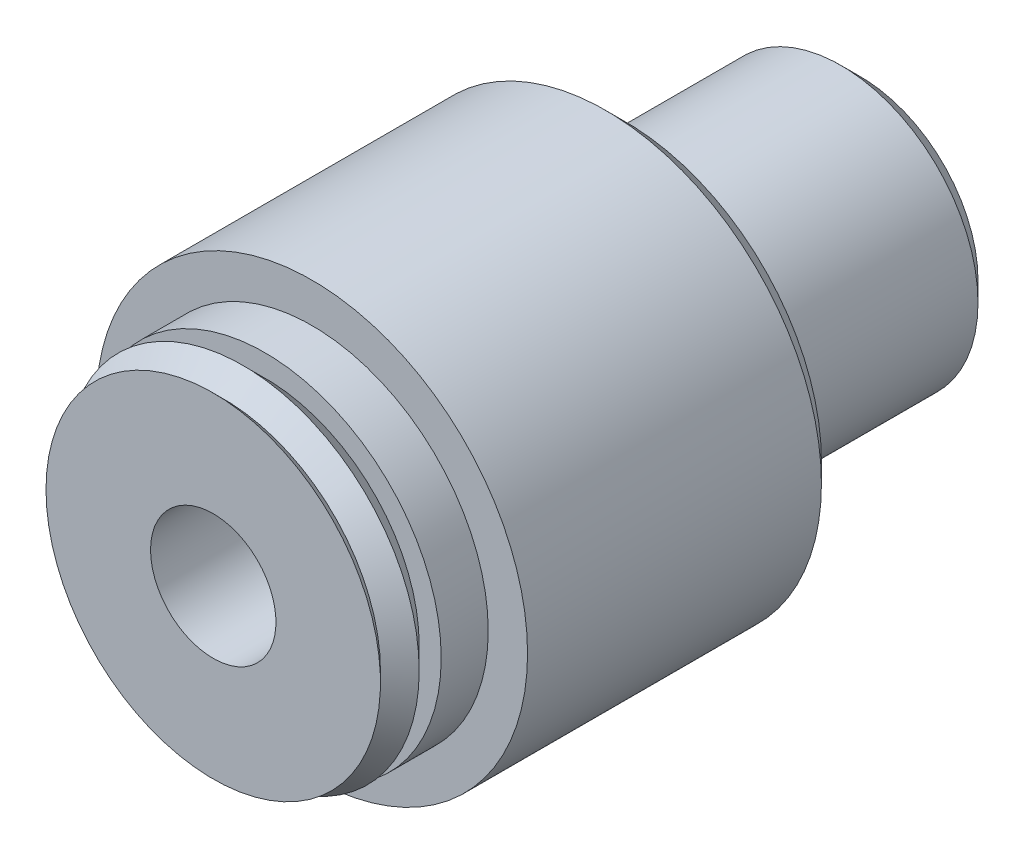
SolidWorks part; units mm, degrees
ref_plane "Front" through (0, 0, 0) normal (0, 0, 1) x (1, 0, 0)
ref_plane "Top" through (0, 0, 0) normal (0, 1, 0) x (1, 0, 0)
ref_plane "Right" through (0, 0, 0) normal (1, 0, 0) x (0, 0, -1)
ref_plane "Body Plane" through (0, 0, -3.9982) normal (0, 0, 1) x (1, 0, 0)
sketch "Sketch1" plane through (0, 0, 0) normal (1, 0, 0) x (0, 0, -1)
  line L0 (71.2941, 0) -> (-67.6458, 0) construction
  line L1 (0, 0) -> (0, 6.7754)
  line L2 (0, 6.7754) -> (0.4166, 6.3589)
  line L3 (0.4166, 6.3589) -> (1.2014, 7.1437)
  line L4 (1.2014, 7.1437) -> (2.0932, 6.252)
  line L5 (2.0932, 6.252) -> (2.0932, 7.1437)
  line L6 (2.0932, 7.1437) -> (3.9982, 7.1437)
  line L7 (3.9982, 7.1437) -> (3.9982, 0)
  line L8 (3.9982, 0) -> (0, 0)
  dimension "D1" = 45
  dimension "D2" = 7.1437
  dimension "外径" = 7.1437
  dimension "D4" = 0.8918
  dimension "D5" = 1.2014
  dimension "D6" = 6.7754
  dimension "Front Length" = 1.905
revolve "Base" add sketch "Sketch1" angle 360 about L0
sketch "Sketch4" plane through (0, 0, -3.9982) normal (0, 0, 1) x (1, 0, 0)
  circle A0 centre (0, 0) radius 8.7376
  dimension "D1" = 17.4752
extrude "Double Acting Stud Body" add sketch "Sketch4" against normal blind 12.7
sketch "Sketch5" plane through (0, 0, -16.6982) normal (0, 0, -1) x (-1, 0, 0)
  circle A0 centre (0, 0) radius 5.5562
  dimension "D1" = 11.1125
extrude "Double Acting Stud Body 2" add sketch "Sketch5" along normal blind 9.525
chamfer "Double Acting Stud Chamfer" distance 0.7937 angle 45 2 edges at (8.7376, 0, -16.6982) (-5.5562, 0, -26.2232)
sketch "Sketch8" plane through (0, 0, 0) normal (1, 0, 0) x (0, 0, -1)
  line L0 (15.9045, 0) -> (3.9982, 0) construction
  line L1 (3.9982, 8.7376) -> (3.9982, -8.7376) construction
  circle A0 centre (7.1732, 0) radius 2.032
  dimension "D1" = 4.064
  dimension "D2" = 3.175
extrude "Double Acting Stud Port A1" cut sketch "Sketch8" against normal through all
sketch "Sketch3" plane through (0, 0, 0) normal (0, 0, -1) x (-1, 0, 0)
  circle A0 centre (0, 0) radius 2.54
  dimension "杆径" = 5.08
extrude "Hole Cut" cut sketch "Sketch3" along normal through all
